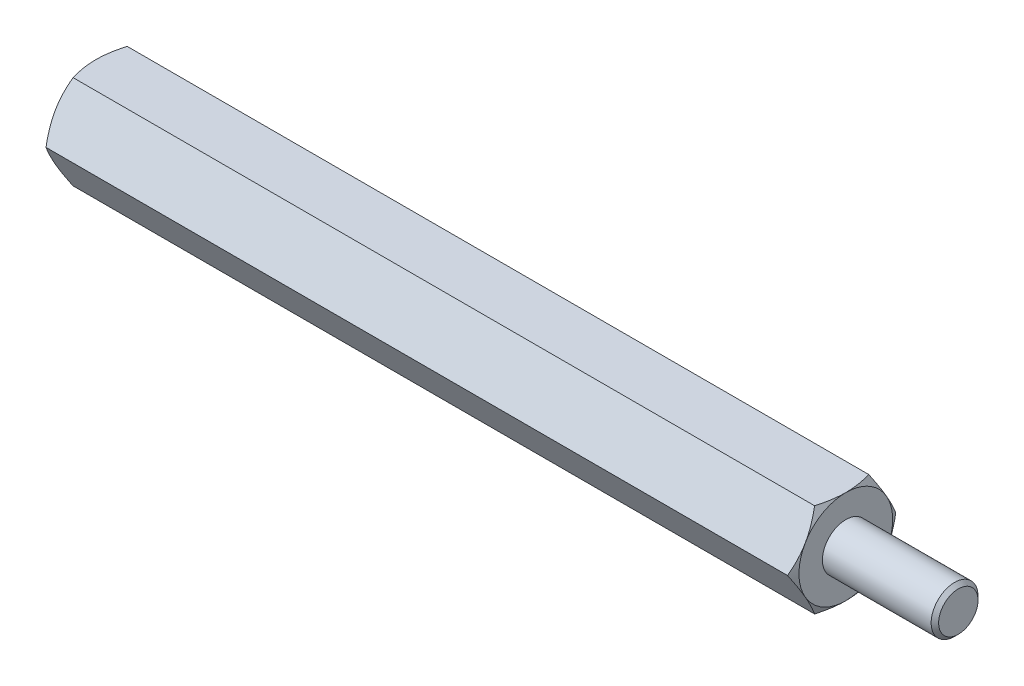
SolidWorks part; units mm, degrees
ref_plane "Front Plane" through (0, 0, 0) normal (0, 0, 1) x (1, 0, 0)
ref_plane "Top Plane" through (0, 0, 0) normal (0, 1, 0) x (1, 0, 0)
ref_plane "Right Plane" through (0, 0, 0) normal (1, 0, 0) x (0, 0, -1)
sketch "Sketch1" plane through (0, 0, 0) normal (1, 0, 0) x (0, 0, -1)
  line L1 (1.4434, 2.5) -> (-1.4434, 2.5)
  line L2 (-1.4434, 2.5) -> (-2.8868, 0)
  line L3 (-2.8868, 0) -> (-1.4434, -2.5)
  line L4 (-1.4434, -2.5) -> (1.4434, -2.5)
  line L5 (1.4434, -2.5) -> (2.8868, 0)
  line L6 (2.8868, 0) -> (1.4434, 2.5)
  circle A0 centre (0, 0) radius 2.5 construction
  dimension "D1" = 5
extrude "Extrude2" add sketch "Sketch1" along normal mid plane 40
sketch "Sketch2" plane through (0, 0, 0) normal (0, 0, 1) x (1, 0, 0)
  line L0 (-20, 2.5) -> (-18.5, 5.0981)
  line L1 (-20, 5.5) -> (-20, 2.5)
  line L3 (0, 0) -> (50000, 0) construction
  arc A0 (-18.5, 5.0981) -> (-20, 5.5) centre (-19.1962, 5.5) ccw
  dimension "D1" = 30
  dimension "D2" = 3
revolve "Cut-Revolve1" cut sketch "Sketch2" angle 360 about L3
mirror "Mirror1" about plane through (0, 0, 0) normal (1, 0, 0) of "Cut-Revolve1"
sketch "Sketch3" plane through (-20, 0, 0) normal (-1, 0, 0) x (0, 0, 1)
  circle A0 centre (0, 0) radius 1.05
  dimension "D1" = 2.1
extrude "Extrude3" cut sketch "Sketch3" against normal blind 6
sketch "Sketch4" plane through (0, 0, 0) normal (0, 0, 1) x (1, 0, 0)
  line L0 (-14, 0) -> (-14, 1.05)
  line L1 (19.7767, 0) -> (-19.7767, 0) construction
  line L2 (-14, 1.05) -> (-13.3938, 0)
  line L3 (-13.3938, 0) -> (-14, 0)
  line L4 (-20, 1.25) -> (-20, -1.25) construction
  point P4 (-20, 0)
  dimension "D1" = 30
  dimension "D2" = 1.05
  dimension "D3" = 6
revolve "Cut-Revolve2" cut sketch "Sketch4" angle 360 about L3
sketch "Sketch5" plane through (20, 0, 0) normal (1, 0, 0) x (0, 0, -1)
  circle A0 centre (0, 0) radius 1.25
  dimension "D1" = 2.5
extrude "Extrude4" add sketch "Sketch5" along normal blind 6
chamfer "Chamfer1" distance 0.2 angle 45 1 edges at (26, 0, -1.25)
equation "\"D2@Sketch4\" = \"D1@Sketch3\"/2"
